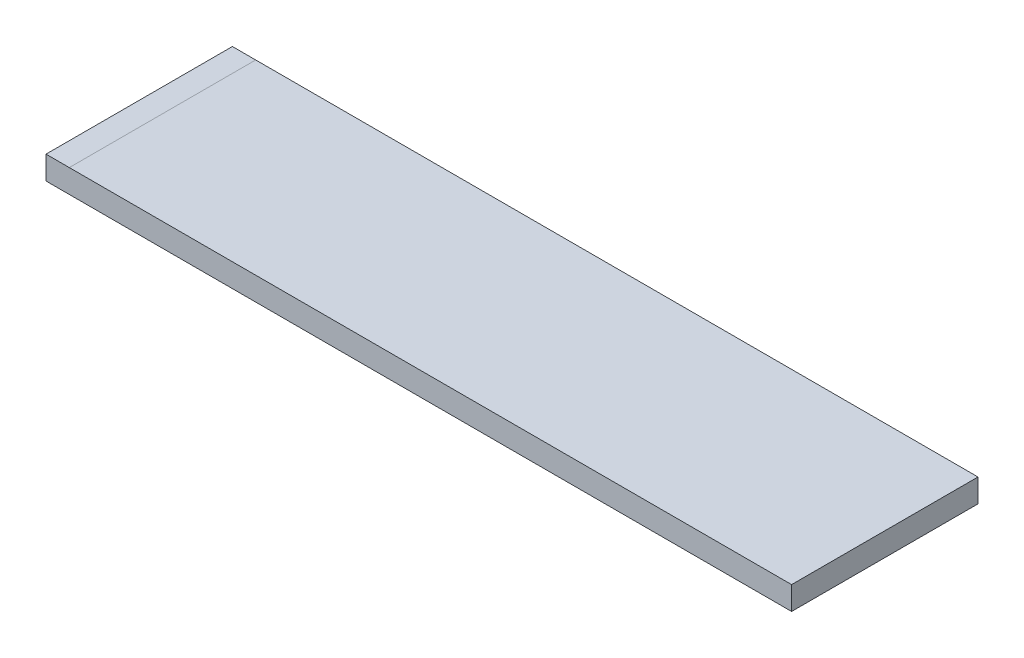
SolidWorks part; units mm, degrees
ref_plane "Front Plane" through (0, 0, 0) normal (0, 0, 1) x (1, 0, 0)
ref_plane "Top Plane" through (0, 0, 0) normal (0, 1, 0) x (1, 0, 0)
ref_plane "Right Plane" through (0, 0, 0) normal (1, 0, 0) x (0, 0, -1)
sketch "Sketch1" plane through (0, 0, 0) normal (0, 0, 1) x (1, 0, 0)
  line L0 (0, 0) -> (203.2, 0)
  dimension "D1" = 203.2
extrude "Extrude-Thin1" add sketch "Sketch1" along normal mid plane 50.8 thin
sketch "Sketch2" plane through (0, 0, 0) normal (0, 1, 0) x (1, 0, 0)
  line L0 (0, -25.4) -> (203.2, -25.4) construction
  line L1 (0, 25.4) -> (6.35, 25.4)
  line L2 (0, 25.4) -> (0, -25.4)
  line L3 (0, -25.4) -> (6.35, -25.4)
  line L4 (6.35, 25.4) -> (6.35, -25.4)
  dimension "D1" = 6.35
extrude "Extrude1" [suppressed] add sketch "Sketch2" along normal blind 152.4 separate body
sketch "Sketch3" [suppressed] plane through (0, 0, 0) normal (-1, 0, 0) x (0, 0, 1)
  line L0 (25.4, 152.4) -> (25.4, 0) construction
  line L1 (-25.4, 152.4) -> (25.4, 152.4)
  line L2 (-25.4, 152.4) -> (-25.4, 146.05)
  line L3 (-25.4, 146.05) -> (25.4, 146.05)
  line L4 (25.4, 152.4) -> (25.4, 146.05)
  dimension "D1" = 6.35
extrude "Extrude2" [suppressed] add sketch "Sketch3" along normal blind 50.8
sketch "Sketch4" plane through (0, 0, 0) normal (0, 1, 0) x (1, 0, 0)
  line L1 (6.35, -25.4) -> (6.35, 25.4)
  line L2 (0, -25.4) -> (0, 25.4) construction
  dimension "D1" = 6.35
sketch "Sketch5" [suppressed] plane through (-50.8, 0, 0) normal (-1, 0, 0) x (0, 0, 1)
  line L0 (0, 152.4) -> (0, 146.05)
  line L1 (25.4, 152.4) -> (-25.4, 152.4) construction
  line L2 (-25.4, 146.05) -> (25.4, 146.05) construction
